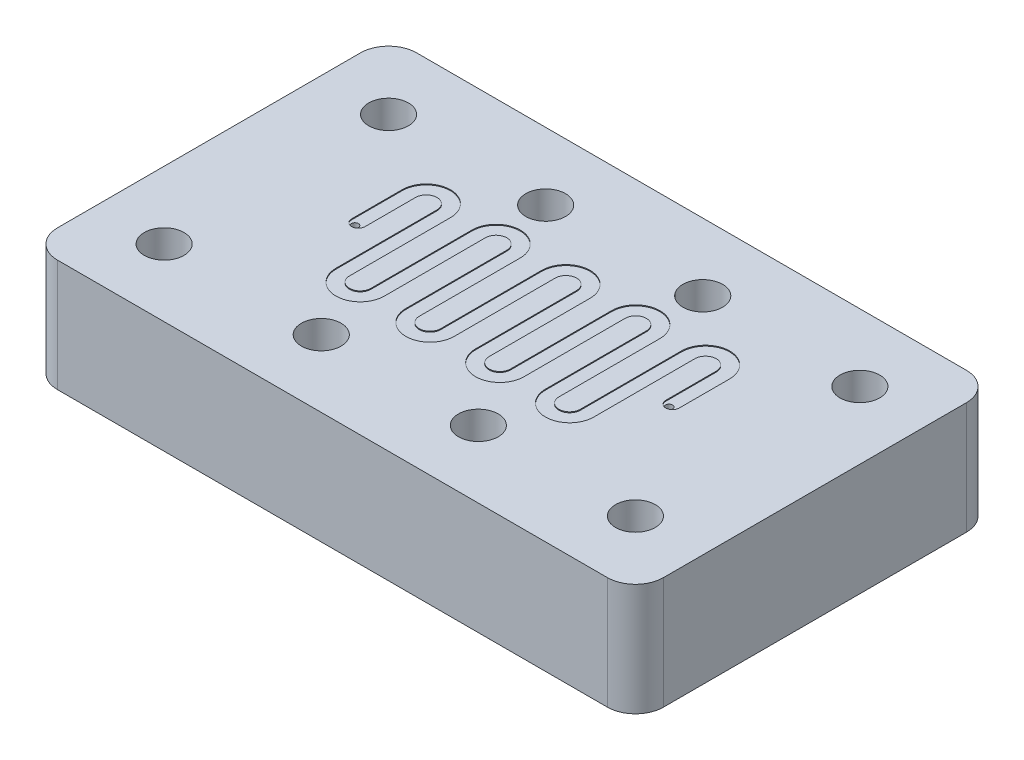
SolidWorks part; units mm, degrees
ref_plane "Front Plane" through (0, 0, 0) normal (0, 0, 1) x (1, 0, 0)
ref_plane "Top Plane" through (0, 0, 0) normal (0, 1, 0) x (1, 0, 0)
ref_plane "Right Plane" through (0, 0, 0) normal (1, 0, 0) x (0, 0, -1)
sketch "Sketch1" plane through (0, 0, 0) normal (0, 1, 0) x (1, 0, 0)
  line L1 (-34.29, 20.32) -> (0, 20.32)
  line L2 (-34.29, 20.32) -> (-34.29, 0)
  line L3 (-34.29, 0) -> (0, 0)
  line L4 (0, 20.32) -> (0, 0)
  dimension "D1" = 34.29
  dimension "D2" = 20.32
extrude "Extrude1" add sketch "Sketch1" along normal blind 12.7
ref_plane "Plane3" [suppressed] through (0, 7.62, 0) normal (0, 1, 0) x (-1, 0, 0)
ref_plane "Plane4" [suppressed] through (0, 8.89, 0) normal (0, 1, 0) x (-1, 0, 0)
sketch "Sketch2" plane through (0, 12.7, 0) normal (0, 1, 0) x (-1, 0, 0)
  circle A0 centre (17.78, 0) radius 0.3937
  dimension "D1" = 20.32
  dimension "D4" = 0.7874
  dimension "D2" = 16.51
extrude "Feed hole" cut sketch "Sketch2" against normal blind 5.08
sketch "Sketch4" plane through (0, 12.7, 0) normal (0, 1, 0) x (-1, 0, 0)
  line L0 (0, -20.32) -> (34.29, -20.32) construction
  line L1 (0, 0) -> (0, -20.32) construction
  circle A0 centre (8.89, -12.7) radius 2.2479
  dimension "D3" = 4.4958
  dimension "D1" = 7.62
  dimension "D2" = 8.89
extrude "Screw hole" cut sketch "Sketch4" against normal through all
pattern_linear "LPattern1" count 2 spacing 17.78 along (-1, 0, 0) of "Screw hole"
fillet "Fillet1" radius 3.175 1 edges at (-34.29, 6.35, -20.32)
mirror "Mirror2" about plane through (-34.29, 12.7, 0) normal (0, 0, -1) of "Fillet1", "LPattern1", "Screw hole", "Feed hole", "Extrude1"
ref_plane "Plane1" through (0, 12.7, 20.32) normal (1, 0, 0) x (0, 0, -1)
mirror "Mirror16" about plane through (0, 12.7, 20.32) normal (1, 0, 0) of "Fillet1", "Feed hole", "Extrude1", "Screw hole", "LPattern1"
mirror "Mirror19" about plane through (34.29, 12.7, 0) normal (0, 0, 1) of "Mirror16", "Feed hole", "Screw hole", "LPattern1", "Fillet1"
sketch "Sketch12" plane through (0, 12.7, 0) normal (0, 1, 0) x (-1, 0, 0)
  line L0 (18.5229, -0.3678) -> (18.5229, -6.0828)
  line L1 (16.9989, -0.3678) -> (16.9989, -6.0828)
  line L2 (14.5718, -6.0828) -> (14.5718, -0.3678)
  line L3 (13.0478, -6.0828) -> (13.0478, -0.3678)
  line L4 (17.7609, -0.3678) -> (17.7609, -6.0828) construction
  line L5 (13.8098, -0.3678) -> (13.8098, -6.0828) construction
  arc A1 (18.5229, -0.3678) -> (16.9989, -0.3678) centre (17.7609, -0.3678) ccw
  arc A2 (18.5229, -6.0828) -> (13.0478, -6.0828) centre (15.7854, -6.0828) cw
  arc A3 (16.9989, -6.0828) -> (14.5718, -6.0828) centre (15.7854, -6.0828) cw
  arc A4 (14.5718, -0.3678) -> (13.0478, -0.3678) centre (13.8098, -0.3678) ccw
  arc A5 (17.7609, -6.0828) -> (13.8098, -6.0828) centre (15.7854, -6.0828) cw construction
  circle A6 centre (17.78, 0) radius 0.3937 construction
  dimension "D1" = 3.9511
  dimension "D2" = 5.715
  dimension "D3" = 0.762
extrude "EqualTop" cut sketch "Sketch12" against normal blind 0.1016
sketch "Sketch13" plane through (0, 12.7, 0) normal (0, 1, 0) x (-1, 0, 0)
  line L0 (14.5718, -0.3678) -> (14.5718, 5.3472)
  line L1 (13.0478, -0.3678) -> (13.0478, 5.3472)
  line L2 (10.6207, -0.3678) -> (10.6207, 5.3472)
  line L3 (9.0967, -0.3678) -> (9.0967, 5.3472)
  line L4 (14.5718, -6.0828) -> (14.5718, -0.3678) construction
  arc A0 (13.0478, -0.3678) -> (14.5718, -0.3678) centre (13.8098, -0.3678) ccw
  arc A1 (9.0967, -0.3678) -> (10.6207, -0.3678) centre (9.8587, -0.3678) ccw
  arc A2 (14.5718, 5.3472) -> (9.0967, 5.3472) centre (11.8343, 5.3472) ccw
  arc A3 (13.0478, 5.3472) -> (10.6207, 5.3472) centre (11.8343, 5.3472) ccw
  arc A4 (14.5718, -0.3678) -> (13.0478, -0.3678) centre (13.8098, -0.3678) ccw construction
  arc A5 (14.5718, -6.0828) -> (16.9989, -6.0828) centre (15.7854, -6.0828) ccw construction
  arc A6 (13.0478, -6.0828) -> (18.5229, -6.0828) centre (15.7854, -6.0828) ccw construction
extrude "EqualBot" cut sketch "Sketch13" against normal up to surface (0.1016 mm away)
pattern_linear "LPattern8" count 5 spacing 7.9022 along (1, 0, 0) of "EqualTop"
pattern_linear "LPattern9" count 4 spacing 7.9022 along (1, 0, 0) of "EqualBot"
sketch "Sketch8" plane through (0, 7.62, 0) normal (0, 1, 0) x (-1, 0, 0)
  circle A0 centre (17.78, 0) radius 2.7051
  circle A1 centre (17.78, 0) radius 0.3937 construction
  dimension "D1" = 5.4102
extrude "Upchurch" [suppressed] cut sketch "Sketch8" against normal through all
pattern_linear "LPattern10" [suppressed] count 2 spacing 35.56
sketch "Sketch15" [suppressed] plane through (0, 12.7, 0) normal (0, 1, 0) x (1, 0, 0)
  line L4 (68.58, -3.175) -> (0, -3.175) construction
  line L5 (68.58, -3.175) -> (0, -3.175)
  line L6 (68.58, -3.175) -> (65.405, -40.64) construction
  line L7 (65.405, -40.64) -> (0, -37.465) construction
  line L8 (-1.27, -3.175) -> (-1.27, -37.465)
  line L9 (3.175, -41.91) -> (65.405, -41.91)
  line L10 (69.85, -37.465) -> (69.85, -3.175)
  line L11 (65.405, 1.27) -> (3.175, 1.27)
  line L12 (-1.27, -3.175) -> (-1.27, -37.465)
  line L13 (3.175, -41.91) -> (65.405, -41.91)
  line L14 (69.85, -37.465) -> (69.85, -3.175)
  line L15 (65.405, 1.27) -> (3.175, 1.27)
  line L16 (0, -3.175) -> (0, -37.465) construction
  line L17 (68.58, -3.175) -> (65.405, -40.64)
  line L18 (65.405, -40.64) -> (0, -37.465)
  line L19 (0, -3.175) -> (0, -37.465)
  arc A4 (-1.27, -37.465) -> (3.175, -41.91) centre (3.175, -37.465) ccw
  arc A5 (-1.27, -37.465) -> (3.175, -41.91) centre (3.175, -37.465) ccw
  arc A6 (65.405, -41.91) -> (69.85, -37.465) centre (65.405, -37.465) ccw
  arc A7 (65.405, -41.91) -> (69.85, -37.465) centre (65.405, -37.465) ccw
  arc A8 (69.85, -3.175) -> (65.405, 1.27) centre (65.405, -3.175) ccw
  arc A9 (69.85, -3.175) -> (65.405, 1.27) centre (65.405, -3.175) ccw
  arc A10 (3.175, 1.27) -> (-1.27, -3.175) centre (3.175, -3.175) ccw
  arc A11 (3.175, 1.27) -> (-1.27, -3.175) centre (3.175, -3.175) ccw
  dimension "D1" = 1.27
extrude "Extrude2" [suppressed] add sketch "Sketch15" against normal up to surface (12.7 mm away)
sketch "Sketch21" plane through (0, 0, 0) normal (0, 0, 1) x (1, 0, 0)
  line L0 (-17.78, 7.62) -> (-17.78, -2.3207) construction
  line L2 (-17.3863, 7.62) -> (-18.1737, 7.62) construction
  line L3 (31.115, 0) -> (-31.115, 0) construction
  line L4 (-17.78, 0) -> (-19.7993, 0)
  line L5 (-19.7993, 0) -> (-19.7993, 6.223)
  line L6 (-19.7993, 6.223) -> (-19.3911, 6.4683)
  line L7 (-19.3911, 6.4683) -> (-18.6309, 8.557)
  line L8 (-18.6309, 8.557) -> (-18.6309, 10.3378)
  line L10 (-17.78, 0) -> (-17.78, 10.3378)
  line L11 (-17.78, 10.3378) -> (-18.6309, 10.3378)
  line L12 (-19.7993, 6.223) -> (-15.7607, 6.223) construction
  line L13 (-19.3911, 6.4683) -> (-16.1689, 6.4683) construction
  line L15 (-16.1689, 6.4683) -> (-15.7607, 6.223) construction
  line L16 (-17.78, 6.4683) -> (-17.78, 6.223) construction
  line L17 (-16.1689, 6.4683) -> (-16.9291, 8.557) construction
  line L18 (-16.9291, 8.557) -> (-18.6309, 8.557) construction
  circle A0 centre (-17.78, 7.4136) radius 1.1906 construction
  point P0 (-19.7993, 4.826)
other "AlignGroup1" parameters "D9"=2.2354, "D1"=0, "D2"=4.826, "D3"=6.223, "D4"=10.3378, "D5"=6.223, "D6"=0.503, "D7"=0.1764, "D8"=1.1269
revolve "10-32 Coned port" cut sketch "Sketch21" angle 360 about L0
pattern_linear "LPattern12" count 2 spacing 35.56 along (1, 0, 0) of "10-32 Coned port"
sketch "Sketch16" [suppressed] plane through (0, 0, 0) normal (0, -1, 0) x (1, 0, 0)
  line L0 (31.115, -20.32) -> (42.545, -20.32)
  line L1 (45.72, -17.145) -> (45.72, 17.145)
  line L2 (31.115, 20.32) -> (42.545, 20.32)
  line L3 (34.29, -17.145) -> (34.29, 17.145) construction
  line L4 (34.29, -17.145) -> (34.29, 17.145)
  line L5 (31.115, 20.32) -> (-31.115, 20.32) construction
  line L6 (31.115, -20.32) -> (-31.115, -20.32) construction
  line L7 (-34.29, -17.145) -> (-34.29, 17.145) construction
  arc A0 (31.115, -20.32) -> (34.29, -17.145) centre (31.115, -17.145) ccw construction
  arc A2 (34.29, 17.145) -> (31.115, 20.32) centre (31.115, 17.145) ccw
  arc A3 (31.115, -20.32) -> (34.29, -17.145) centre (31.115, -17.145) ccw
  arc A4 (42.545, -20.32) -> (45.72, -17.145) centre (42.545, -17.145) ccw
  arc A5 (42.545, 20.32) -> (45.72, 17.145) centre (42.545, 17.145) cw
  arc A6 (34.29, 17.145) -> (31.115, 20.32) centre (31.115, 17.145) ccw construction
  dimension "D1" = 80.01
extrude "Electrode extension" [suppressed] add sketch "Sketch16" against normal up to surface (12.7 mm away)
sketch "Sketch17" plane through (0, 7.62, 0) normal (0, -1, 0) x (-1, 0, 0)
  line L0 (-17.78, 0) -> (46.8556, 0) construction
  line L1 (-17.78, 0) -> (-45.72, 0)
  line L2 (-17.78, 0) -> (-17.78, 0.3937)
  line L3 (-17.78, 0.3937) -> (-35.3822, 0.3937)
  line L4 (-35.3822, 0.3937) -> (-35.3822, 0.8509)
  line L5 (-35.3822, 0.8509) -> (-37.1602, 0.8509)
  line L6 (-45.72, 17.145) -> (-45.72, -17.145) construction
  line L7 (-45.72, 2.0193) -> (-45.72, 0)
  line L21 (-37.1602, 0.8509) -> (-39.2525, 1.6124)
  line L22 (-39.2525, 1.6124) -> (-39.497, 2.0193)
  line L23 (-39.497, 2.0193) -> (-45.72, 2.0193)
  line L24 (-45.72, 17.145) -> (-45.72, -17.145) construction
  line L25 (-45.72, 0) -> (-95.0882, 0) construction
  circle A0 centre (-17.78, 0) radius 0.3937 construction
other "AlignGroup3" parameters "D1"=5.2144, "D2"=22.9404, "D3"=22.9404, "D4"=40, "D5"=2.5773, "D6"=0, "D7"=6.223, "D8"=8.557, "D9"=10.3378, "D10"=4.0386, "D11"=0, "D12"=6.223, "D13"=8.5598, "D14"=10.3378, "D15"=6.223, "D16"=1.778, "D17"=2.0193
revolve "10-32 port outlet" [suppressed] cut sketch "Sketch17" angle 360 about L0
sketch "Sketch18" [suppressed] plane through (0, 8.89, 0) normal (0, -1, 0) x (1, 0, 0)
  line L0 (17.78, 0) -> (17.78, 16.3796) construction
  line L1 (17.78, 0) -> (17.78, 20.32)
  line L2 (17.78, 20.32) -> (15.7729, 20.32)
  line L3 (15.7729, 20.32) -> (15.7729, 14.097)
  line L4 (17.3863, 9.9836) -> (16.9291, 9.9836)
  line L5 (17.3863, 9.9836) -> (17.3863, 0)
  line L6 (17.3863, 0) -> (17.78, 0)
  line L7 (16.9291, 9.9836) -> (16.9291, 11.7616)
  line L8 (16.9291, 11.7616) -> (16.1841, 13.8598)
  line L9 (16.1841, 13.8598) -> (15.7729, 14.097)
  line L10 (42.545, 20.32) -> (-31.115, 20.32) construction
  line L12 (36.2712, 0.8509) -> (36.2712, 0) construction
  line L13 (37.1602, 0.8509) -> (35.3822, 0.8509) construction
  line L14 (39.497, 2.0193) -> (39.497, 0) construction
  line L15 (39.497, -2.0193) -> (39.497, 2.0193) construction
  line L16 (45.72, 2.0193) -> (39.497, 2.0193) construction
  line L18 (39.497, 2.0193) -> (39.2525, 1.6124) construction
  line L20 (39.2525, 1.6124) -> (37.1602, 0.8509) construction
  line L22 (35.3822, -0.8509) -> (37.1602, -0.8509) construction
  line L24 (16.9291, 11.7616) -> (17.78, 11.7616) construction
  line L25 (37.1602, 0.8509) -> (45.72, 0.8509) construction
  line L26 (45.72, -17.145) -> (45.72, 17.145) construction
  line L27 (16.9291, 11.7616) -> (16.7765, 20.32) construction
  circle A1 centre (17.78, 0) radius 0.3937 construction
  dimension "D1" = 0.7874
  dimension "D2" = 59
revolve "10-32 electrode port" [suppressed] cut sketch "Sketch18" angle 360 about L0
mirror "Mirror20" [suppressed] about plane through (0, 0, 0) normal (0, 0, 1)
pattern_linear "LPattern11" [suppressed] count 2 spacing 15.24 count 2 spacing 1.27
sketch "Sketch19" [suppressed] plane through (0, 3.175, 0) normal (0, 1, 0) x (1, 0, 0)
  line L0 (0, -8.255) -> (0, -20.32) construction
  line L1 (-22.225, 8.255) -> (22.225, 8.255)
  line L2 (-25.4, 5.08) -> (-25.4, -5.08)
  line L3 (-22.225, -8.255) -> (22.225, -8.255)
  line L4 (25.4, 5.08) -> (25.4, -5.08)
  line L5 (31.115, -20.32) -> (-31.115, -20.32) construction
  line L6 (-25.4, 0) -> (-34.29, 0) construction
  line L7 (-34.29, 17.145) -> (-34.29, -17.145) construction
  line L8 (-26.67, 12.7) -> (-8.89, 12.7) construction
  line L9 (8.89, 12.7) -> (26.67, 12.7) construction
  line L10 (-26.67, -12.7) -> (-8.89, -12.7) construction
  line L11 (8.89, -12.7) -> (26.67, -12.7) construction
  arc A0 (22.225, 8.255) -> (25.4, 5.08) centre (22.225, 5.08) cw
  arc A1 (22.225, -8.255) -> (25.4, -5.08) centre (22.225, -5.08) ccw
  arc A2 (-25.4, -5.08) -> (-22.225, -8.255) centre (-22.225, -5.08) ccw
  arc A3 (-22.225, 8.255) -> (-25.4, 5.08) centre (-22.225, 5.08) ccw
  arc A4 (34.29, 17.145) -> (31.115, 20.32) centre (31.115, 17.145) ccw construction
  circle A5 centre (-26.67, 12.7) radius 2.2479 construction
  circle A6 centre (-17.78, 12.7) radius 1.7272
  circle A7 centre (17.78, 12.7) radius 1.7272
  circle A8 centre (17.78, -12.7) radius 1.7272
  circle A9 centre (-17.78, -12.7) radius 1.7272
  circle A10 centre (26.67, -12.7) radius 2.2479 construction
  dimension "D1" = 16.51
  dimension "D3" = 3.4544
  dimension "D2" = 50.8
extrude "Cut-Extrude1" [suppressed] cut sketch "Sketch19" against normal through all
sketch "Sketch20" [suppressed] plane through (0, 6.35, 0) normal (0, -1, 0) x (1, 0, 0)
  circle A0 centre (52.07, 20.32) radius 0.7937
  dimension "D1" = 1.5875
extrude "Cut-Extrude2" [suppressed] cut sketch "Sketch20" against normal blind 0.889
ref_plane "Plane5" through (0, 0, 20.32) normal (0, 0, 1) x (1, 0, 0)
sketch "Sketch22" [suppressed] plane through (0, 0, 0) normal (0, -1, 0) x (1, 0, 0)
  line L0 (15.24, 0) -> (17.78, 0) construction
  line L1 (17.78, -0.3937) -> (17.78, 0.3937) construction
  circle A0 centre (15.24, 0) radius 1.0922
  dimension "D1" = 2.1844
  dimension "D2" = 2.54
extrude "Thermistor hole" [suppressed] cut sketch "Sketch22" against normal blind 8.89
